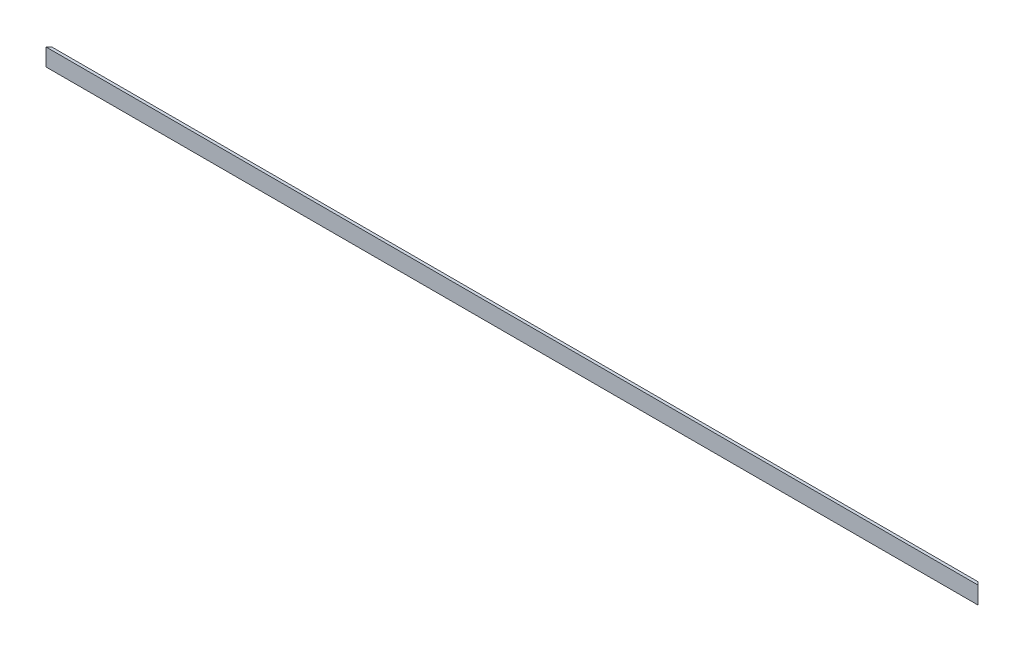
SolidWorks part; units mm, degrees
ref_plane "Front Plane" through (0, 0, 0) normal (0, 0, 1) x (1, 0, 0)
ref_plane "Top Plane" through (0, 0, 0) normal (0, 1, 0) x (1, 0, 0)
ref_plane "Right Plane" through (0, 0, 0) normal (1, 0, 0) x (0, 0, -1)
sketch "Sketch1" plane through (0, 0, 0) normal (1, 0, 0) x (0, 0, -1)
  line L0 (0, 0) -> (0, 38.1)
  line L1 (0, 38.1) -> (6.35, 38.1)
  line L2 (6.35, 38.1) -> (6.35, 6.35)
  line L3 (0, 0) -> (38.1, 0)
  line L4 (38.1, 0) -> (38.1, 6.35)
  line L5 (38.1, 6.35) -> (6.35, 6.35)
  dimension "D1" = 38.1
  dimension "D2" = 38.1
  dimension "D3" = 6.35
  dimension "D4" = 6.35
extrude "Boss-Extrude1" add sketch "Sketch1" along normal blind 2047.24
sketch "Sketch2" plane through (0, 0, 0) normal (0, 1, 0) x (1, 0, 0)
  line L0 (0, 0) -> (38.1, 38.1)
  line L1 (2047.24, 38.1) -> (0, 38.1) construction
  line L2 (38.1, 38.1) -> (0, 38.1)
  line L3 (0, 38.1) -> (0, 6.35) construction
  line L4 (0, 38.1) -> (0, 0)
  line L5 (2047.24, 0) -> (2009.14, 38.1)
  line L6 (2009.14, 38.1) -> (2047.24, 38.1)
  line L7 (2047.24, 38.1) -> (2047.24, 0)
extrude "Cut-Extrude3" cut sketch "Sketch2" along normal through all
